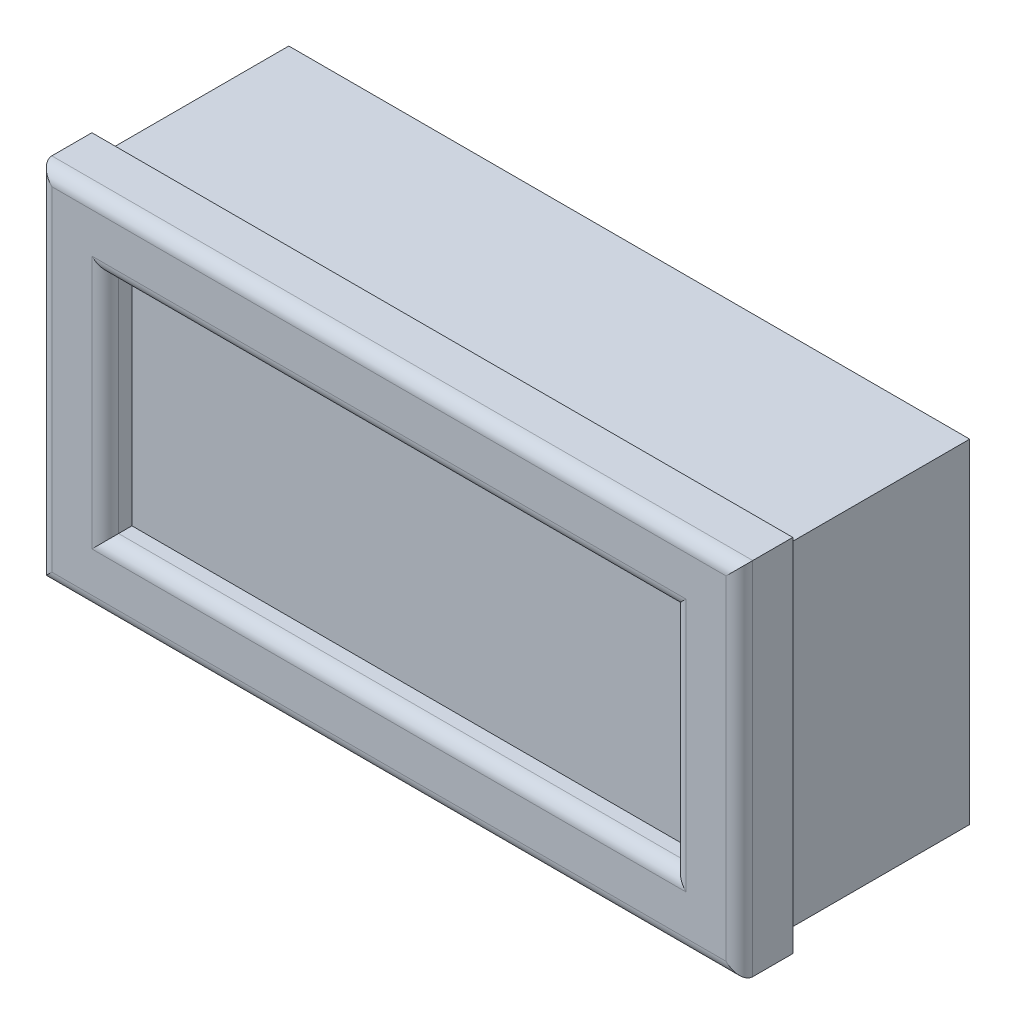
SolidWorks part; units mm, degrees
ref_plane "Plan de face" through (0, 0, 0) normal (0, 0, 1) x (1, 0, 0)
ref_plane "Plan de dessus" through (0, 0, 0) normal (0, 1, 0) x (1, 0, 0)
ref_plane "Plan de droite" through (0, 0, 0) normal (1, 0, 0) x (0, 0, -1)
sketch "Esquisse1" plane through (0, 0, 0) normal (0, 0, 1) x (1, 0, 0)
  line L1 (-23.2116, 11.596) -> (29.2884, 11.596)
  line L2 (-23.2116, 11.596) -> (-23.2116, -15.404)
  line L3 (-23.2116, -15.404) -> (29.2884, -15.404)
  line L4 (29.2884, 11.596) -> (29.2884, -15.404)
  dimension "D1" = 52.5
  dimension "D2" = 27
extrude "Boss.-Extru.1" add sketch "Esquisse1" along normal blind 4
sketch "Esquisse2" plane through (0, 0, 4) normal (0, 0, 1) x (1, 0, 0)
  line L0 (-23.2116, 11.596) -> (-23.2116, -15.404) construction
  line L1 (-18.2116, 6.596) -> (24.2884, 6.596)
  line L2 (-18.2116, 6.596) -> (-18.2116, -10.404)
  line L3 (-18.2116, -10.404) -> (24.2884, -10.404)
  line L4 (24.2884, 6.596) -> (24.2884, -10.404)
  line L5 (29.2884, 11.596) -> (-23.2116, 11.596) construction
  line L6 (-23.2116, -15.404) -> (29.2884, -15.404) construction
  line L7 (29.2884, -15.404) -> (29.2884, 11.596) construction
  dimension "D1" = 5
  dimension "D2" = 5
  dimension "D3" = 5
  dimension "D4" = 5
extrude "Enlèv. mat.-Extru.1" cut sketch "Esquisse2" against normal blind 2
sketch "Esquisse3" plane through (0, 0, 0) normal (0, 0, -1) x (-1, 0, 0)
  line L0 (-29.2884, -15.404) -> (-29.2884, 11.596) construction
  line L1 (-28.5384, 10.596) -> (22.4616, 10.596)
  line L2 (-28.5384, 10.596) -> (-28.5384, -14.404)
  line L3 (-28.5384, -14.404) -> (22.4616, -14.404)
  line L4 (22.4616, 10.596) -> (22.4616, -14.404)
  line L5 (-29.2884, 11.596) -> (23.2116, 11.596) construction
  dimension "D1" = 51
  dimension "D2" = 0.75
  dimension "D3" = 25
  dimension "D4" = 1
extrude "Boss.-Extru.2" add sketch "Esquisse3" along normal blind 14
fillet "Congé1" radius 1 8 edges at (3.0384, 11.596, 4) (29.2884, -1.904, 4) (3.0384, -15.404, 4) (-23.2116, -1.904, 4) (3.0384, -10.404, 4) (24.2884, -1.904, 4) (3.0384, 6.596, 4) (-18.2116, -1.904, 4)
sketch "Esquisse4" plane through (0, 0, -14) normal (0, 0, -1) x (-1, 0, 0)
  line L0 (22.4616, -14.404) -> (22.4616, 10.596) construction
  line L1 (22.4616, -14.404) -> (22.4616, 10.596) construction
  line L2 (22.4616, 10.596) -> (-28.5384, 10.596) construction
  line L3 (22.4616, 10.596) -> (-28.5384, 10.596) construction
  circle A0 centre (5.4616, 4.596) radius 1.5
  circle A1 centre (12.4616, 4.596) radius 1.5
  dimension "D1" = 10
  dimension "D2" = 17
  dimension "D3" = 6
  dimension "D4" = 6
extrude "Boss.-Extru.3" add sketch "Esquisse4" along normal blind 1.5
